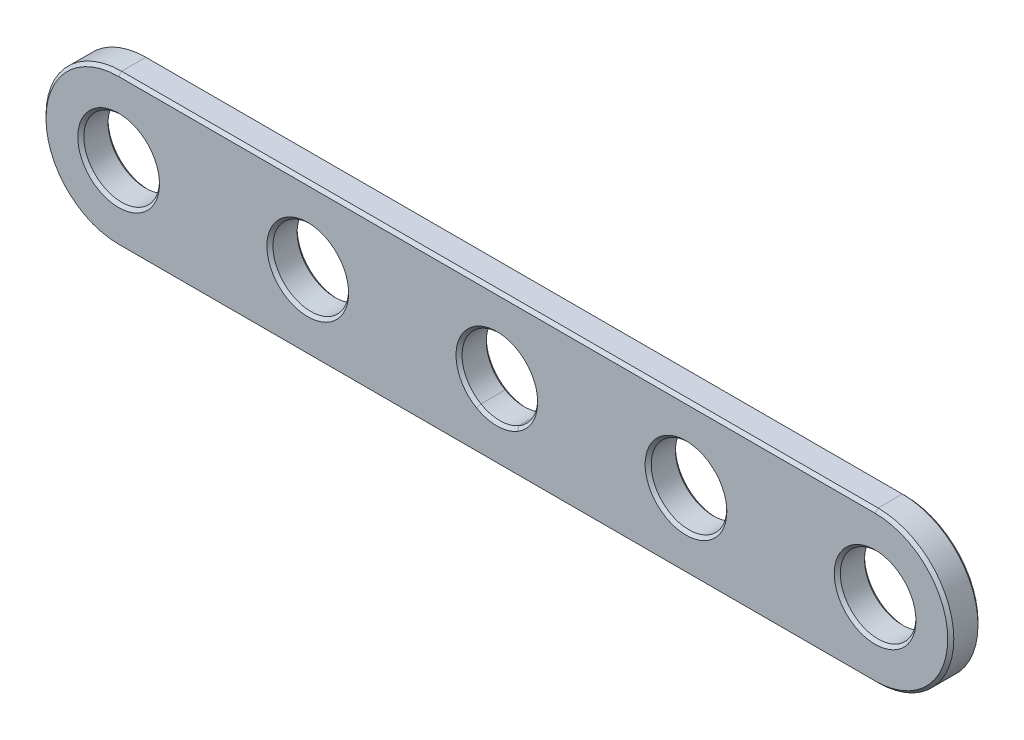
SolidWorks part; units mm, degrees
ref_plane "Front" through (0, 0, 0) normal (0, 0, 1) x (1, 0, 0)
ref_plane "Top" through (0, 0, 0) normal (0, 1, 0) x (1, 0, 0)
ref_plane "Right" through (0, 0, 0) normal (1, 0, 0) x (0, 0, -1)
sketch "Sketch1" plane through (0, 0, 0) normal (0, 0, 1) x (1, 0, 0)
  line L0 (250, 222.6284) -> (250, -151.5336) construction
  line L1 (0, 0) -> (500, 0)
  line L3 (0, 100) -> (500, 100)
  arc A0 (0, 100) -> (0, 0) centre (0, 50) ccw
  arc A1 (500, 100) -> (500, 0) centre (500, 50) cw
  point P1 (250, 0)
  point P10 (250, 100)
  dimension "D2" = 500
  dimension "D1" = 100
extrude "Base-Extrude" add sketch "Sketch1" along normal blind 20
sketch "Sketch2" plane through (0, 0, 20) normal (0, 0, 1) x (1, 0, 0)
  circle A0 centre (0, 50) radius 25
  arc A1 (0, 100) -> (0, 0) centre (0, 50) ccw construction
  dimension "D1" = 50
extrude "Cut-Extrude1" cut sketch "Sketch2" against normal through all
pattern_linear "LPattern1" count 5 spacing 125 along (1, 0, 0) of "Cut-Extrude1"
sketch "Sketch6" plane through (0, 0, 0) normal (0, 1, 0) x (1, 0, 0)
  line L0 (250, 24.303) -> (250, -37.3782) construction
  line L1 (250, 0) -> (250, -20) construction
  line L2 (500, -20) -> (0, -20) construction
  line L3 (500, 0) -> (0, 0) construction
  line L4 (262.5, -20) -> (237.5, -20)
  line L5 (262.5, 0) -> (237.5, 0)
  line L6 (262.5, 0) -> (262.5, -20)
  line L7 (237.5, 0) -> (237.5, -20)
  dimension "D1" = 25
sketch "Sketch3" plane through (0, 0, 20) normal (0, 0, 1) x (1, 0, 0)
  line L0 (250, 189.4512) -> (250, -67.8587)
  circle A0 centre (0, 50) radius 25 construction
  dimension "D1" = 250
extrude "Cut-Extrude2" [suppressed] cut sketch "Sketch3" against normal through all and the other way through all
chamfer "Chamfer1" distance 2 angle 45 24 edges at (250, 0, 0) (550, 50, 0) (-50, 50, 0) (250, 100, 0) (250, 0, 20) (550, 50, 20) (-50, 50, 20) (250, 100, 20) (250, 75, 20) (275, 50, 20) (250, 25, 20) (225, 50, 20) (250, 75, 0) (225, 50, 0) (250, 25, 0) (275, 50, 0) (525, 50, 0) (525, 50, 20) (400, 50, 20) (400, 50, 0) (150, 50, 0) (150, 50, 20) (25, 50, 0) (25, 50, 20)
equation "\"D3@LPattern1\" = \"D2@Sketch1\" / (\"D1@LPattern1\"-1)"
